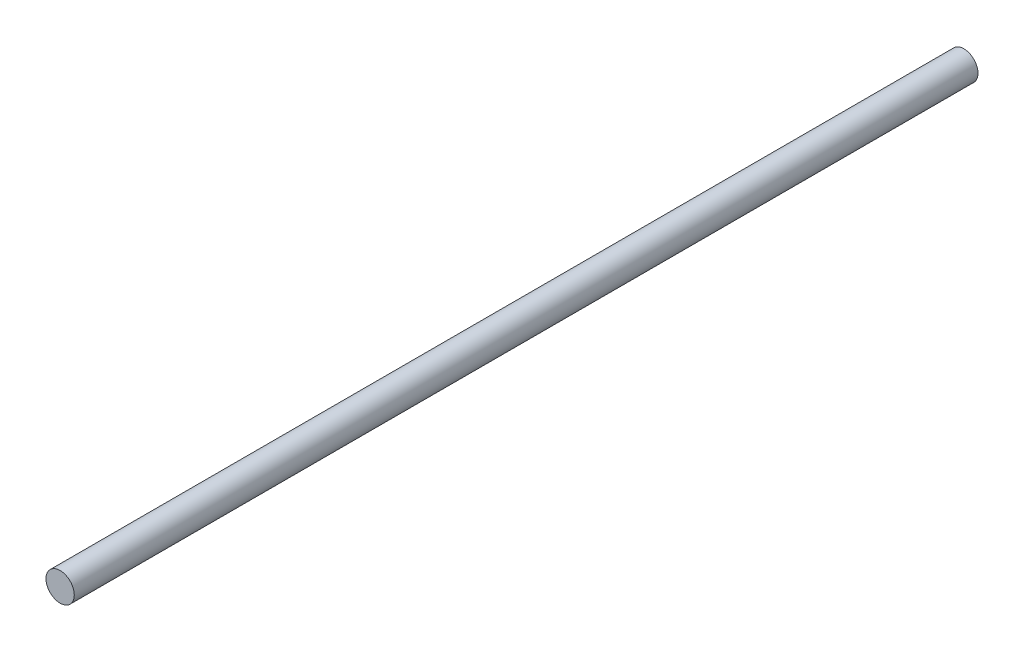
SolidWorks part; units mm, degrees
ref_plane "Front Plane" through (0, 0, 0) normal (0, 0, 1) x (1, 0, 0)
ref_plane "Top Plane" through (0, 0, 0) normal (0, 1, 0) x (1, 0, 0)
ref_plane "Right Plane" through (0, 0, 0) normal (1, 0, 0) x (0, 0, -1)
sketch "Sketch1" plane through (0, 0, 0) normal (0, 0, 1) x (1, 0, 0)
  circle A0 centre (0, 0) radius 8.001
extrude "Boss-Extrude1" add sketch "Sketch1" along normal blind 510.8829
